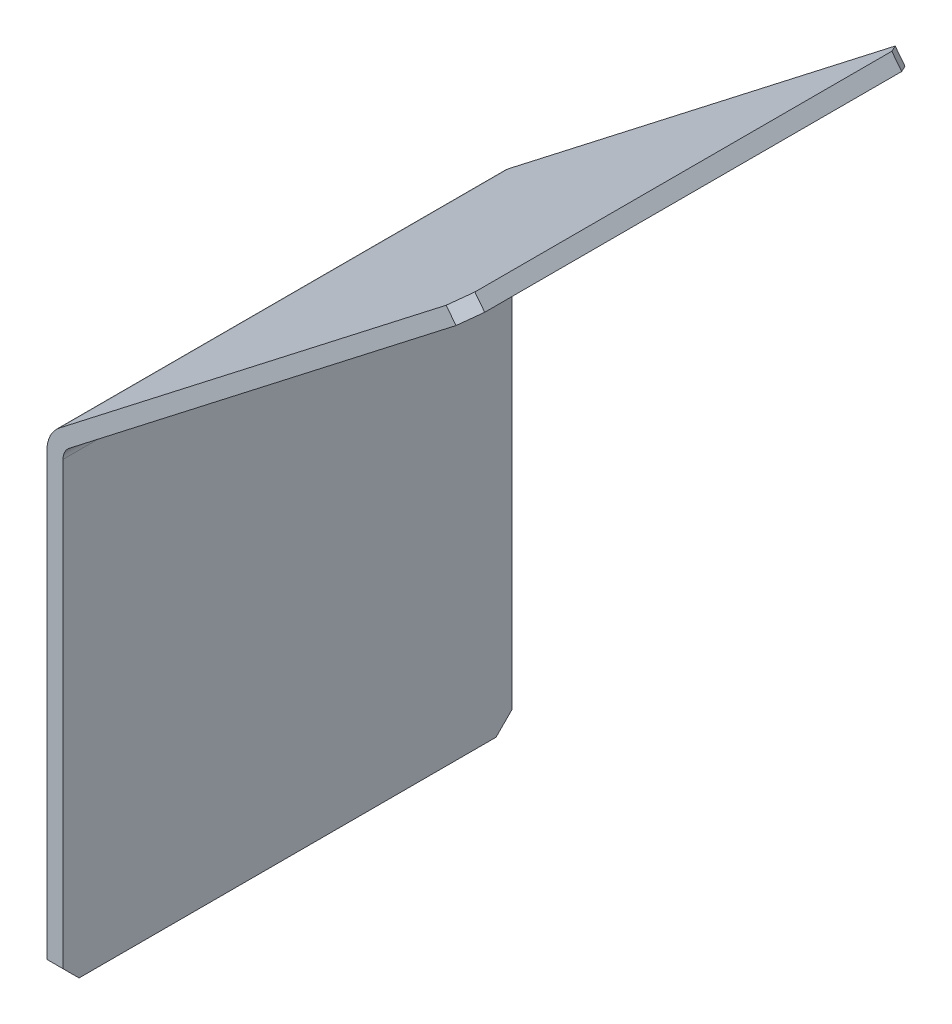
SolidWorks part; units mm, degrees
ref_plane "Plan de face" through (0, 0, 0) normal (0, 0, 1) x (1, 0, 0)
ref_plane "Plan de dessus" through (0, 0, 0) normal (0, 1, 0) x (1, 0, 0)
ref_plane "Plan de droite" through (0, 0, 0) normal (1, 0, 0) x (0, 0, -1)
sketch "Esquisse1" plane through (0, 0, 0) normal (0, 0, 1) x (1, 0, 0)
  line L0 (0, 0) -> (0, 145)
  line L1 (0, 145) -> (126.4753, 243)
  dimension "D1" = 145
  dimension "D2" = 160
  dimension "D3" = 98
extrude "Extru.-Mince1" add sketch "Esquisse1" along normal mid plane 140 thin
chamfer "Chanfrein1" distance 5 angle 45 2 edges at (-2.5, 0, -70) (-2.5, 0, 70)
chamfer "Chanfrein2" distance 5 angle 45 2 edges at (124.944, 244.9762, -70) (124.944, 244.9762, 70)
